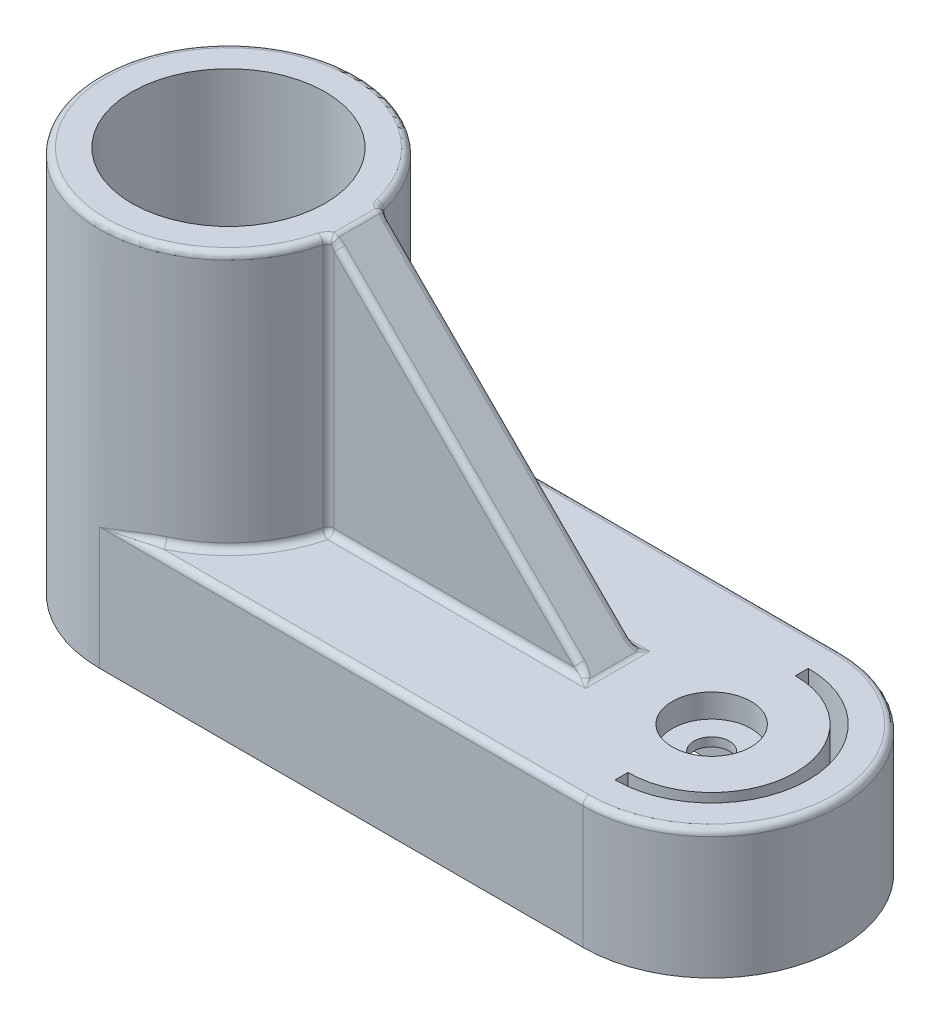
SolidWorks part; units mm, degrees
ref_plane "Alzado" through (0, 0, 0) normal (0, 0, 1) x (1, 0, 0)
ref_plane "Planta" through (0, 0, 0) normal (0, 1, 0) x (1, 0, 0)
ref_plane "Vista lateral" through (0, 0, 0) normal (1, 0, 0) x (0, 0, -1)
sketch "Croquis1" plane through (0, 0, 0) normal (0, 1, 0) x (1, 0, 0)
  line L0 (-75, 0) -> (75, 0) construction
  line L1 (-75, 20) -> (75, 20)
  line L2 (-75, -20) -> (75, -20)
  arc A0 (-75, 20) -> (-75, -20) centre (-75, 0) ccw
  arc A1 (75, -20) -> (75, 20) centre (75, 0) ccw
  point P2 (0, 0)
  dimension "D2" = 20
  dimension "D1" = 150
extrude "Base Elíptica" add sketch "Croquis1" along normal blind 20
sketch "Croquis2" plane through (0, 20, 0) normal (0, 1, 0) x (1, 0, 0)
  line L0 (-75, -20) -> (75, -20) construction
  circle A0 centre (0, 0) radius 20
extrude "Saliente Cilíndrica" add sketch "Croquis2" along normal blind 40
shell "Vaciado" thickness 5
sketch "Croquis3" plane through (0, 0, 0) normal (0, 0, 1) x (1, 0, 0)
  line L0 (60, 20) -> (20, 60)
  line L1 (0, 20) -> (75, 20) construction
  line L2 (20, 20) -> (20, 60) construction
  line L4 (20, 60) -> (20, 20) construction
  line L5 (20, 20) -> (60, 20)
  line L6 (-75, 20) -> (0, 20) construction
  line L7 (20, 60) -> (15, 60)
  line L8 (15, 60) -> (15, 20)
  line L9 (15, 15) -> (15, 60) construction
  line L10 (15, 20) -> (20, 20)
  dimension "D1" = 45
extrude "Nervio" add sketch "Croquis3" against normal mid plane 8
fillet "Redondeo Exterior Nervio" radius 1 7 edges at (19.798, 60, 4) (19.5959, 40, 4) (39.798, 20, 4) (39.798, 20, -4) (60, 20, 0) (19.798, 60, -4) (19.5959, 40, -4)
fillet "Redondeo Interior Nervio" radius 1 8 edges at (39.698, 40.302, 4) (39.698, 40.302, -4) (20.1939, 59.8061, 4.0207) (59.3827, 20.6173, 4.0761) (59.3827, 20.6173, -4.0761) (20.1939, 59.8061, -4.0207) (60.0315, 20.0761, 4.6173) (60.0315, 20.0761, -4.6173)
sketch "Croquis5" plane through (0, 20, 0) normal (0, 1, 0) x (1, 0, 0)
  arc A8 (-75, 15) -> (-75, -15) centre (-75, 0) ccw
  arc A9 (-75, 15) -> (-75, -15) centre (-75, 0) ccw
  arc A11 (75, -15) -> (75, 15) centre (75, 0) ccw
  arc A12 (75, -15) -> (75, 15) centre (75, 0) ccw
  dimension "D1" = 5
  dimension "D2" = 5
extrude "Corte" cut sketch "Croquis5" against normal blind 20 thin
hole_wizard "Refrentado para tornillo con cabeza hueca hexagonal de M51" positions "Croquis7" profile "Croquis6" counterbore size "M5" standard "Ansi Metric"
sketch "Croquis7" plane through (0, 20, 0) normal (0, 1, 0) x (1, 0, 0)
  arc A4 (75, -13) -> (75, 13) centre (75, 0) ccw construction
  point P1 (75, 0)
sketch "Croquis6" plane through (75, 20, 0) normal (1, 0, 0) x (0, 0, 1)
  line L0 (0, 0) -> (0, 20)
  line L1 (0, 20) -> (2.75, 20)
  line L3 (2.75, 20) -> (2.75, 3.65)
  line L4 (2.75, 3.65) -> (6.12, 3.65)
  line L5 (6.12, 3.65) -> (6.12, 0)
  line L7 (6.12, 0) -> (0, 0)
  line L11 (0, -6.35) -> (0, 107.95) construction
  dimension "Diámetro de taladro hasta el siguiente" = 5.5
  dimension "Profundidad de taladro hasta el siguiente" = 20
  dimension "Diámetro de refrentado" = 12.24
  dimension "Profundidad de refrentado" = 3.65
sketch "Croquis8" plane through (0, 20, 0) normal (0, 1, 0) x (1, 0, 0)
  line L2 (0, 20) -> (-75, 20)
  line L3 (-75, -20) -> (0, -20)
  line L4 (0, 20) -> (-75, 20)
  line L5 (-75, -20) -> (0, -20)
  arc A2 (0, 20) -> (0, -20) centre (0, 0) ccw
  arc A3 (-75, 20) -> (-75, -20) centre (-75, 0) ccw
  arc A4 (0, 20) -> (0, -20) centre (0, 0) ccw
  arc A5 (-75, 20) -> (-75, -20) centre (-75, 0) ccw
  dimension "D1" = 0
extrude "Cortar-Extruir1" cut sketch "Croquis8" against normal blind 34
sketch "Croquis9" plane through (0, 15, 0) normal (0, -1, 0) x (1, 0, 0)
  line L2 (0, 15) -> (-13.2288, 15)
  line L3 (-13.2288, -15) -> (0, -15)
  line L4 (0, 15) -> (-13.2288, 15)
  line L5 (-13.2288, -15) -> (0, -15)
  arc A2 (-13.2288, 15) -> (-13.2288, -15) centre (0, 0) ccw
  arc A3 (0, 15) -> (0, -15) centre (0, 0) ccw
  arc A4 (-13.2288, 15) -> (-13.2288, -15) centre (0, 0) ccw
  arc A5 (0, 15) -> (0, -15) centre (0, 0) ccw
  dimension "D1" = 0
extrude "Saliente-Extruir1" add sketch "Croquis9" along normal blind 15
fillet "Redondeo1" radius 1 6 edges at (19.4532, 60, -4.6668) (19.9138, 60, -3.751) (20, 60, 0) (19.9521, 60, 3.6374) (19.4532, 60, 4.6668) (-20, 60, 0)
fillet "Redondeo2" radius 1 3 edges at (37.5, 20, -20) (95, 20, 0) (37.5, 20, 20)
fillet "Redondeo3" radius 1 9 edges at (14.5934, 20, 13.676) (4.3137, 19.8485, -19.5293) (4.3137, 19.8485, 19.5293) (14.5934, 20, -13.676)
